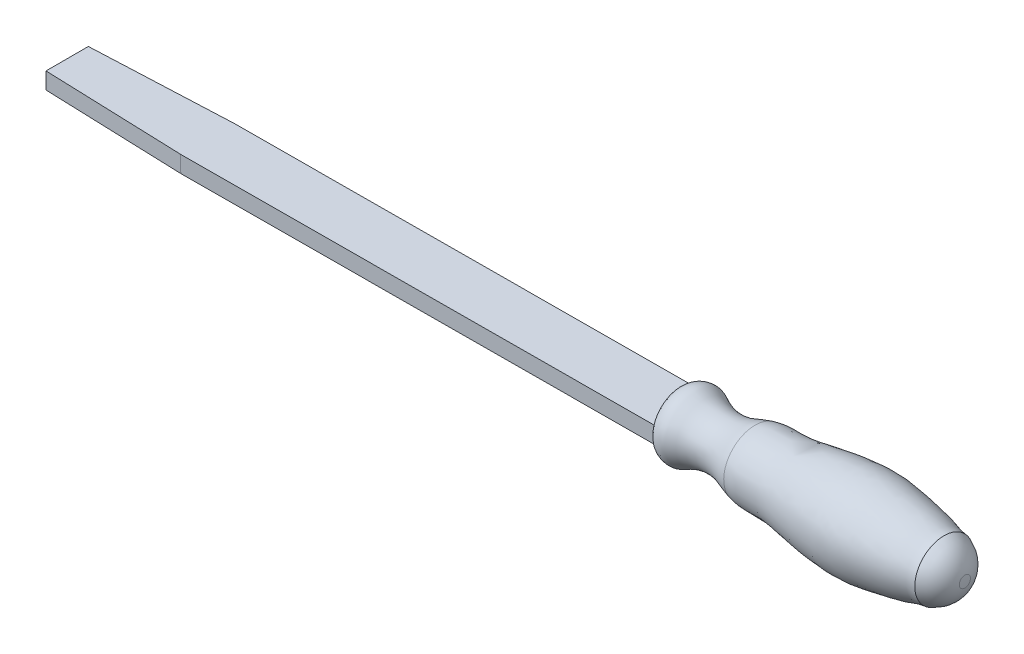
SolidWorks part; units mm, degrees
ref_plane "Front" through (0, 0, 0) normal (0, 0, 1) x (1, 0, 0)
ref_plane "Top" through (0, 0, 0) normal (0, 1, 0) x (1, 0, 0)
ref_plane "Right" through (0, 0, 0) normal (1, 0, 0) x (0, 0, -1)
sketch "Esquisse1" plane through (0, 0, 0) normal (0, 0, 1) x (1, 0, 0)
  line L0 (-5.4706, 0.3329) -> (111.2269, -11.1094) construction
  line L1 (0, 0) -> (0, -3.4014)
  line L2 (0, 0) -> (203.8198, 0.9847) construction
  line L4 (0, 0) -> (112, 0.5411)
  spline S0 degree 2 poles (0, -3.4014) (-0.1556, -7.1644) (0.5454, -10.8775) knots 0 0 0 1 1 1
  spline S1 degree 3 poles (0.5454, -10.8775) (1.3703, -11.9744) (3.3226, -12.8302) (6.1946, -12.9244) (8.2173, -11.8859) (10.5137, -10.6745) (13.2815, -9.8087) (16.632, -9.2235) (20.2629, -9.326) (24.1568, -10.1634) (27.1906, -11.5587) (29.1633, -12.0599) (29.7779, -12.2061) knots 0 0 0 0 0.120356 0.182103 0.252494 0.320379 0.416926 0.51167 0.625759 0.741662 0.867963 0.924774 0.924774 0.924774 0.924774
  spline S2 degree 3 poles (29.7779, -12.2061) (31.1346, -12.4504) (33.1676, -12.8911) (36.3876, -12.9051) (39.1715, -12.8799) (42.6259, -12.9791) (46.218, -13.347) (49.9167, -14.0068) (53.6218, -14.6405) (57.2662, -15.1744) (61.1202, -15.6812) (65.1405, -15.9976) (69.272, -16.4214) (73.6066, -16.3521) (77.7839, -16.2162) (81.9902, -15.5316) (86.3141, -14.804) (91.8474, -13.8515) (97.7509, -12.539) (101.9294, -10.9604) (103.8184, -10.9882) knots 0 0 0 0 0.055398 0.082677 0.128818 0.167035 0.221097 0.273334 0.317568 0.371734 0.420941 0.473294 0.533363 0.587168 0.646878 0.700632 0.757711 0.822668 0.925589 1 1 1 1
  spline S3 degree 3 poles (103.8184, -10.9882) (105.3866, -10.3956) (109.2102, -8.227) (111.463, -4.2308) (111.9223, -1.6522) knots 0 0 0 0 0.390825 1 1 1 1
  spline S8 degree 2 poles (112, 0.5411) (112.0053, -0.5553) (111.9223, -1.6522) knots 0.5 0.5 0.5 1 1 1
  point P4 (69.7283, -16.1677)
  point P17 (73.8825, -16.1677)
  point P30 (77.9798, -15.8262)
  point P34 (64.9481, -15.9969)
  point P36 (73.9963, -16.4522)
  point P38 (77.9229, -16.1107)
  point P40 (81.9064, -15.5417)
  point P42 (69.5576, -16.3953)
  point P44 (73.8758, -16.4365)
  point P46 (69.4314, -16.3439)
  point P48 (73.4592, -16.3439)
  dimension "D1" = 112
revolve "Révolution2" add sketch "Esquisse1" angle 360 about L4
ref_plane "Plan1" through (-0.0164, -0.0001, 0) normal (1, 0.0048, 0) x (0, 0, -1)
sketch "Esquisse4" plane through (-0.0164, -0.0001, 0) normal (1, 0.0048, 0) x (0, 0, -1)
  line L1 (-10.5, -3.25) -> (10.5, -3.25)
  line L2 (-10.5, -3.25) -> (-10.5, 3.25)
  line L3 (-10.5, 3.25) -> (10.5, 3.25)
  line L4 (10.5, -3.25) -> (10.5, 3.25)
  line L5 (-10.5, -3.25) -> (10.5, 3.25) construction
  line L6 (-10.5, 3.25) -> (10.5, -3.25) construction
  point P0 (0, 0)
  dimension "D1" = 6.5
  dimension "D2" = 21
extrude "Boss.-Extru.2" add sketch "Esquisse4" against normal blind 240 and the other way up to next
sketch "Esquisse5" plane through (-0.0157, 3.25, 0) normal (-0.0048, 1, 0) x (1, 0.0048, 0)
  line L0 (-240.0164, 8.3) -> (-185.0164, 10.5)
  line L1 (-240.0164, 10.5) -> (-240.0164, -10.5) construction
  line L2 (-240.0164, 10.5) -> (0.5788, 10.5) construction
  line L3 (-185.0164, 10.5) -> (-240.0164, 10.5)
  line L4 (-240.0164, 10.5) -> (-240.0164, 8.3)
  dimension "D1" = 55
  dimension "D2" = 2.2
extrude "Enlèv. mat.-Extru.1" cut sketch "Esquisse5" against normal through all
mirror "Symétrie1" about plane through (0, 0, 0) normal (0, 0, 1) of "Enlèv. mat.-Extru.1"
